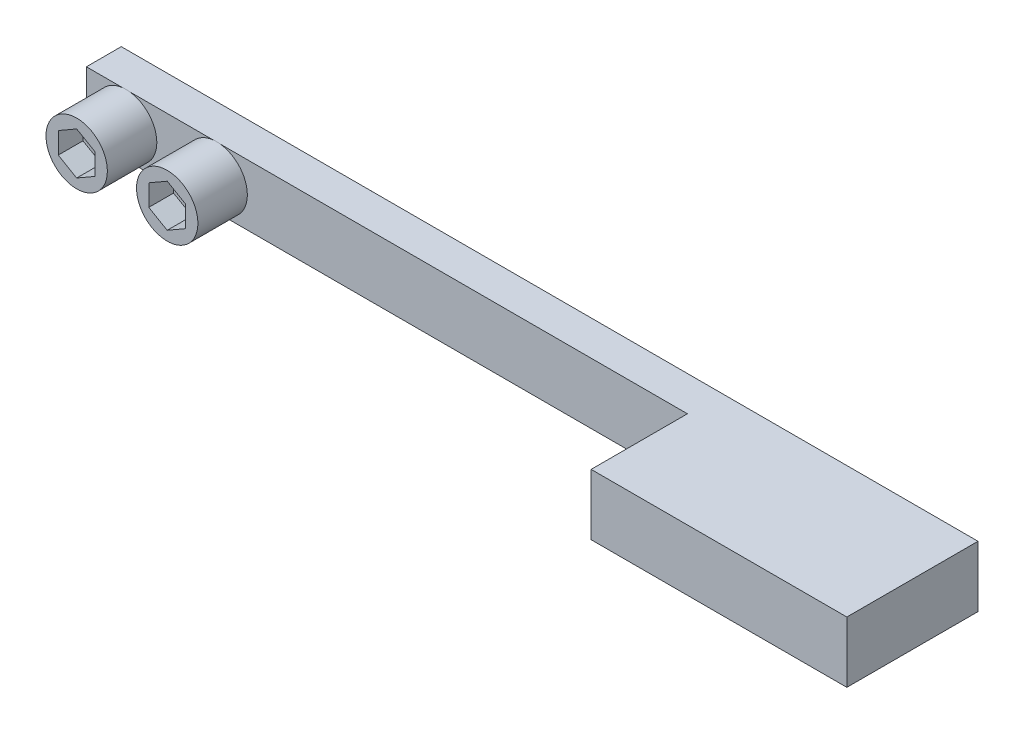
SolidWorks part; units mm, degrees
ref_plane "Front Plane" through (0, 0, 0) normal (0, 0, 1) x (1, 0, 0)
ref_plane "Top Plane" through (0, 0, 0) normal (0, 1, 0) x (1, 0, 0)
ref_plane "Right Plane" through (0, 0, 0) normal (1, 0, 0) x (0, 0, -1)
ref_plane "Plane1" through (-24.638, 0, 0) normal (1, 0, 0) x (0, 0, -1)
ref_plane "Plane2" through (0, 0, -1.0033) normal (0, 0, 1) x (1, 0, 0)
ref_plane "Plane3" through (0, -1.7526, 0) normal (0, 1, 0) x (-1, 0, 0)
sketch "Sketch1" plane through (0, -1.7526, 0) normal (0, 1, 0) x (-1, 0, 0)
  line L0 (24.638, -1.0033) -> (24.638, 1.0033)
  line L1 (24.638, 1.0033) -> (-9.9314, 1.0033)
  line L2 (-9.9314, 1.0033) -> (-9.9314, 6.5405)
  line L3 (-9.9314, 6.5405) -> (-24.638, 6.5405)
  line L4 (-24.638, 6.5405) -> (-24.638, -1.0033)
  line L5 (-24.638, -1.0033) -> (24.638, -1.0033)
extrude "Extrude1" add sketch "Sketch1" along normal blind 3.5052
ref_plane "Plane4" through (0, 0, 1.0033) normal (0, 0, 1) x (1, 0, 0)
sketch "Sketch2" plane through (0, 0, 1.0033) normal (0, 0, 1) x (1, 0, 0)
  circle A0 centre (-22.352, 0) radius 1.7653
extrude "Extrude2" add sketch "Sketch2" along normal blind 2.8448
ref_plane "Plane5" through (0, 0, 3.8481) normal (0, 0, 1) x (1, 0, 0)
sketch "Sketch3" plane through (0, 0, 3.8481) normal (0, 0, 1) x (1, 0, 0)
  line L0 (-23.4112, 0.6115) -> (-23.4112, -0.6115)
  line L1 (-23.4112, -0.6115) -> (-22.352, -1.223)
  line L2 (-22.352, -1.223) -> (-21.2928, -0.6115)
  line L3 (-21.2928, -0.6115) -> (-21.2928, 0.6115)
  line L4 (-21.2928, 0.6115) -> (-22.352, 1.223)
  line L5 (-22.352, 1.223) -> (-23.4112, 0.6115)
extrude "Cut-Extrude1" cut sketch "Sketch3" against normal blind 1.4224
sketch "Sketch4" plane through (0, 0, 1.0033) normal (0, 0, 1) x (1, 0, 0)
  circle A0 centre (-17.145, 0) radius 1.7653
sketch "Sketch5" plane through (0, 0, 3.8481) normal (0, 0, 1) x (1, 0, 0)
  line L0 (-18.2042, 0.6115) -> (-18.2042, -0.6115)
  line L1 (-18.2042, -0.6115) -> (-17.145, -1.223)
  line L2 (-17.145, -1.223) -> (-16.0858, -0.6115)
  line L3 (-16.0858, -0.6115) -> (-16.0858, 0.6115)
  line L4 (-16.0858, 0.6115) -> (-17.145, 1.223)
  line L5 (-17.145, 1.223) -> (-18.2042, 0.6115)
extrude "Extrude3" add sketch "Sketch4" along normal blind 2.8448
extrude "Cut-Extrude2" cut sketch "Sketch5" against normal blind 1.4224
